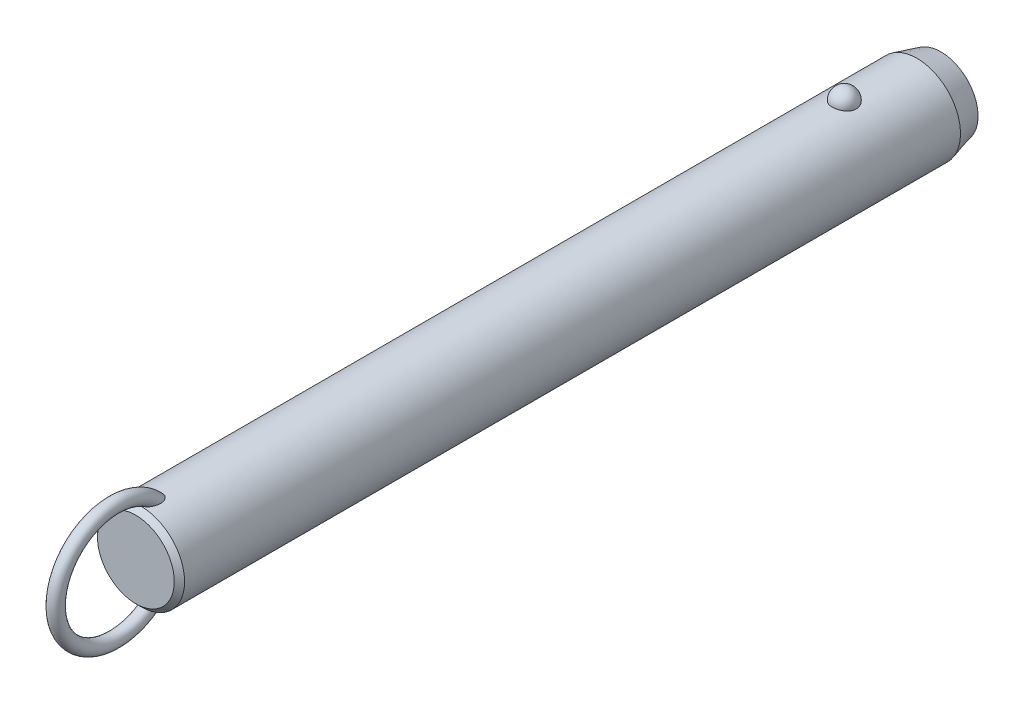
SolidWorks part; units mm, degrees
ref_plane "Front Plane" through (0, 0, 0) normal (0, 0, 1) x (1, 0, 0)
ref_plane "Top Plane" through (0, 0, 0) normal (0, 1, 0) x (1, 0, 0)
ref_plane "Right Plane" through (0, 0, 0) normal (1, 0, 0) x (0, 0, -1)
sketch "Sketch2" plane through (0, 0, 0) normal (0, 0, 1) x (1, 0, 0)
  circle A0 centre (0, 0) radius 12.7
  point P3 (0, 12.7)
  dimension "D1" = 25.4
extrude "Boss-Extrude1" add sketch "Sketch2" along normal blind 190.5
sketch "Sketch3" plane through (0, 0, 0) normal (0, 0, -1) x (-1, 0, 0)
  circle A0 centre (0, 0) radius 12.7
  dimension "D1" = 25.4
extrude "Boss-Extrude2" add sketch "Sketch3" along normal blind 31.7
chamfer "Chamfer1" distance 7 angle 15 1 edges at (-12.7, 0, -31.7)
sketch "Sketch12" plane through (0, 0, 0) normal (1, 0, 0) x (0, 0, -1)
  line L0 (-190.5, 12.7) -> (-190.5, -12.7) construction
  point P0 (-190.5, 0)
sketch "Sketch13" plane through (0, 0, 0) normal (1, 0, 0) x (0, 0, -1)
  circle A0 centre (-209.55, 0) radius 19.05
  point P2 (-190.5, 0)
  dimension "D1" = 38.1
sketch "Sketch14" plane through (0, 0, 0) normal (0, 1, 0) x (1, 0, 0)
  circle A0 centre (0, -192.5) radius 2
  point P2 (0, -190.5)
  dimension "D1" = 4
sweep "Sweep1" add profiles "Sketch14" path "Sketch13"
sketch "Sketch15" plane through (0, 0, 190.5) normal (0, 0, 1) x (1, 0, 0)
  circle A0 centre (0, 0) radius 12.7
  dimension "D1" = 25.4
extrude "Boss-Extrude3" add sketch "Sketch15" along normal blind 12.7
chamfer "Chamfer2" distance 1.5 angle 45 1 edges at (12.7, 0, 203.2)
sketch "Sketch18" plane through (0, 0, 0) normal (1, 0, 0) x (0, 0, -1)
  line L0 (24.7, 12.7) -> (-195.351, 12.7) construction
  line L1 (3.5, 16.2) -> (3.5, 9.2)
  line L2 (-195.351, -12.7) -> (24.7, -12.7) construction
  arc A0 (3.5, 16.2) -> (3.5, 9.2) centre (3.5, 12.7) ccw
  point P4 (0, 12.7)
  dimension "D1" = 28.9
revolve "Revolve1" add sketch "Sketch18" angle 360 about L1
